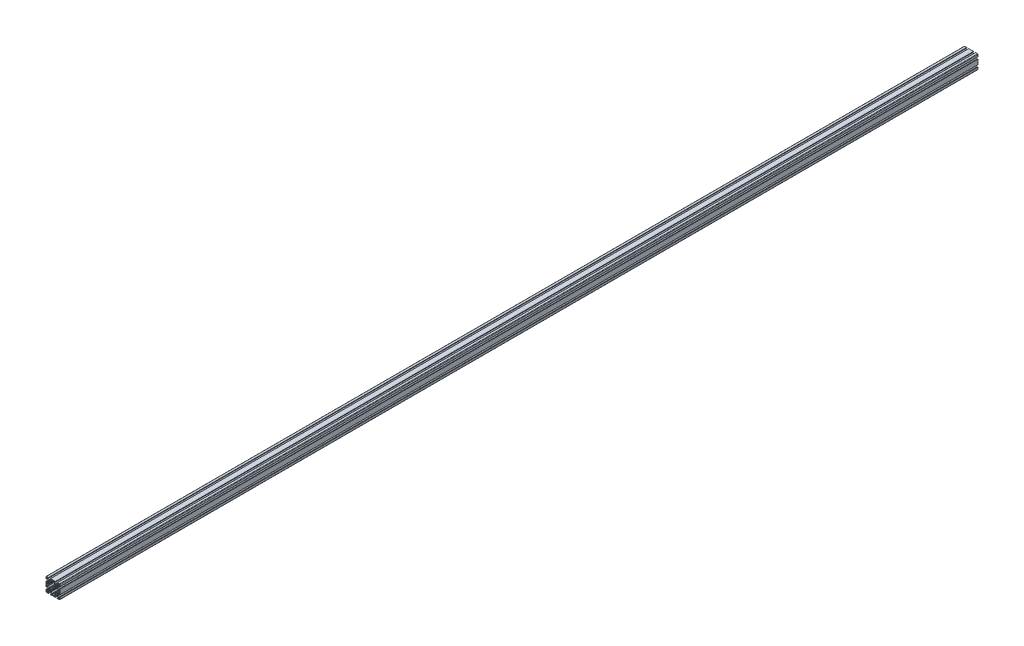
SolidWorks part; units mm, degrees
ref_plane "Front Plane" through (0, 0, 0) normal (0, 0, 1) x (1, 0, 0)
ref_plane "Top Plane" through (0, 0, 0) normal (0, 1, 0) x (1, 0, 0)
ref_plane "Right Plane" through (0, 0, 0) normal (1, 0, 0) x (0, 0, -1)
sketch "Sketch1" plane through (0, 0, 0) normal (0, 0, 1) x (1, 0, 0)
  line L0 (-13.319, -39.4999) -> (-9.88, -39.4999)
  line L1 (-9.5, -39.8799) -> (-9.5, -43.3189)
  line L2 (-9.881, -43.6999) -> (-12.7, -43.6999)
  line L3 (-13.7, -42.6999) -> (-13.7, -39.8809)
  line L4 (39.4999, -43.3189) -> (39.4999, -39.8799)
  line L5 (39.8799, -39.4999) -> (43.3189, -39.4999)
  line L6 (43.6999, -39.8809) -> (43.6999, -42.6999)
  line L7 (42.6999, -43.6999) -> (39.8809, -43.6999)
  line L8 (39.8809, 13.7) -> (42.6999, 13.7)
  line L9 (43.6999, 12.7) -> (43.6999, 9.881)
  line L10 (43.3189, 9.5) -> (39.8799, 9.5)
  line L11 (39.4999, 9.88) -> (39.4999, 13.319)
  line L12 (-9.5, 13.319) -> (-9.5, 9.88)
  line L13 (-9.88, 9.5) -> (-13.319, 9.5)
  line L14 (-13.7, 9.881) -> (-13.7, 12.7)
  line L15 (-12.7, 13.7) -> (-9.881, 13.7)
  line L16 (-1.4942, -3.1981) -> (-2.4733, -3.9799)
  line L17 (-3.9799, -2.4733) -> (-3.1981, -1.4942)
  line L18 (-3.1981, 1.4942) -> (-3.9799, 2.4733)
  line L19 (-2.4733, 3.9799) -> (-1.4942, 3.1981)
  line L20 (1.4942, 3.1981) -> (2.4733, 3.9799)
  line L21 (3.9799, 2.4733) -> (3.1981, 1.4942)
  line L22 (3.1981, -1.4942) -> (3.9799, -2.4733)
  line L23 (2.4733, -3.9799) -> (1.4942, -3.1981)
  line L24 (28.5057, -3.1981) -> (27.5266, -3.9799)
  line L25 (26.02, -2.4733) -> (26.8018, -1.4942)
  line L26 (26.8018, 1.4942) -> (26.02, 2.4733)
  line L27 (27.5266, 3.9799) -> (28.5057, 3.1981)
  line L28 (31.4942, 3.1981) -> (32.4733, 3.9799)
  line L29 (33.9799, 2.4733) -> (33.1981, 1.4942)
  line L30 (33.1981, -1.4942) -> (33.9799, -2.4733)
  line L31 (32.4733, -3.9799) -> (31.4942, -3.1981)
  line L32 (-1.4942, -33.1981) -> (-2.4733, -33.9799)
  line L33 (-3.9799, -32.4733) -> (-3.1981, -31.4942)
  line L34 (-3.1981, -28.5057) -> (-3.9799, -27.5266)
  line L35 (-2.4733, -26.02) -> (-1.4942, -26.8018)
  line L36 (1.4942, -26.8018) -> (2.4733, -26.02)
  line L37 (3.9799, -27.5266) -> (3.1981, -28.5057)
  line L38 (3.1981, -31.4942) -> (3.9799, -32.4733)
  line L39 (2.4733, -33.9799) -> (1.4942, -33.1981)
  line L40 (28.5057, -33.1981) -> (27.5266, -33.9799)
  line L41 (26.02, -32.4733) -> (26.8018, -31.4942)
  line L42 (26.8018, -28.5057) -> (26.02, -27.5266)
  line L43 (27.5266, -26.02) -> (28.5057, -26.8018)
  line L44 (31.4942, -26.8018) -> (32.4733, -26.02)
  line L45 (33.9799, -27.5266) -> (33.1981, -28.5057)
  line L46 (33.1981, -31.4942) -> (33.9799, -32.4733)
  line L47 (32.4733, -33.9799) -> (31.4942, -33.1981)
  line L48 (42.7999, -10.95) -> (42.7999, -19.05)
  line L49 (42.2999, -19.55) -> (39.2681, -19.55)
  line L50 (38.2075, -19.9893) -> (34.178, -24.0188)
  line L51 (33.8244, -24.1653) -> (30.9499, -24.1653)
  line L52 (30.9499, -24.1653) -> (29.9999, -24.6753)
  line L53 (29.9999, -24.6753) -> (29.0499, -24.1653)
  line L54 (29.0499, -24.1653) -> (26.1653, -24.1653)
  line L55 (24.1653, -26.1653) -> (24.1653, -29.1124)
  line L56 (24.1653, -29.1124) -> (24.6753, -30.0624)
  line L57 (24.6753, -30.0624) -> (24.1653, -31.0124)
  line L58 (24.1653, -31.0124) -> (24.1653, -33.8244)
  line L59 (24.0188, -34.178) -> (19.9893, -38.2075)
  line L60 (19.55, -39.2681) -> (19.55, -42.2999)
  line L61 (19.05, -42.7999) -> (10.95, -42.7999)
  line L62 (10.45, -42.2999) -> (10.45, -39.2681)
  line L63 (10.0106, -38.2075) -> (5.9811, -34.178)
  line L64 (5.8347, -33.8244) -> (5.8347, -31.0124)
  line L65 (5.8347, -31.0124) -> (5.3247, -30.0624)
  line L66 (5.3247, -30.0624) -> (5.8347, -29.1124)
  line L67 (5.8347, -29.1124) -> (5.8347, -26.1653)
  line L68 (3.8347, -24.1653) -> (0.95, -24.1653)
  line L69 (0.95, -24.1653) -> (0, -24.6753)
  line L70 (0, -24.6753) -> (-0.95, -24.1653)
  line L71 (-0.95, -24.1653) -> (-3.8245, -24.1653)
  line L72 (-4.178, -24.0188) -> (-8.2075, -19.9893)
  line L73 (-9.2682, -19.55) -> (-12.3, -19.55)
  line L74 (-12.8, -19.05) -> (-12.8, -10.95)
  line L75 (-12.3, -10.45) -> (-9.2682, -10.45)
  line L76 (-8.2075, -10.0106) -> (-4.178, -5.9811)
  line L77 (-3.8245, -5.8347) -> (-0.95, -5.8347)
  line L78 (-0.95, -5.8347) -> (0, -5.3247)
  line L79 (0, -5.3247) -> (0.95, -5.8347)
  line L80 (0.95, -5.8347) -> (3.8347, -5.8347)
  line L81 (5.8347, -3.8347) -> (5.8347, -1.0125)
  line L82 (5.8347, -1.0125) -> (5.3247, -0.0625)
  line L83 (5.3247, -0.0625) -> (5.8347, 0.8875)
  line L84 (5.8347, 0.8875) -> (5.8347, 3.8245)
  line L85 (5.9811, 4.178) -> (10.0106, 8.2075)
  line L86 (10.45, 9.2682) -> (10.45, 12.3)
  line L87 (10.95, 12.8) -> (19.05, 12.8)
  line L88 (19.55, 12.3) -> (19.55, 9.2682)
  line L89 (19.9893, 8.2075) -> (24.0188, 4.178)
  line L90 (24.1653, 3.8245) -> (24.1653, 0.8875)
  line L91 (24.1653, 0.8875) -> (24.6753, -0.0625)
  line L92 (24.6753, -0.0625) -> (24.1653, -1.0125)
  line L93 (24.1653, -1.0125) -> (24.1653, -3.8347)
  line L94 (26.1653, -5.8347) -> (29.0499, -5.8347)
  line L95 (29.0499, -5.8347) -> (29.9999, -5.3247)
  line L96 (29.9999, -5.3247) -> (30.9499, -5.8347)
  line L97 (30.9499, -5.8347) -> (33.8244, -5.8347)
  line L98 (34.178, -5.9811) -> (38.2075, -10.0106)
  line L99 (39.2681, -10.45) -> (42.2999, -10.45)
  line L100 (-14.5, -25.9999) -> (-13.2425, -25.9999)
  line L101 (-12.7425, -25.4999) -> (-12.7425, -22.2674)
  line L102 (-12.2428, -21.75) -> (-10.2602, -21.75)
  line L103 (-9.9067, -21.8964) -> (-5.9811, -25.8219)
  line L104 (-5.8347, -26.1755) -> (-5.8347, -29.1124)
  line L105 (-5.8347, -29.1124) -> (-5.3247, -30.0624)
  line L106 (-5.3247, -30.0624) -> (-5.8347, -31.0124)
  line L107 (-5.8347, -31.0124) -> (-5.8347, -33.8244)
  line L108 (-5.9811, -34.178) -> (-9.9067, -38.1035)
  line L109 (-10.2602, -38.2499) -> (-12.2428, -38.2499)
  line L110 (-12.7425, -37.7325) -> (-12.7425, -34.4999)
  line L111 (-13.2425, -33.9999) -> (-14.5, -33.9999)
  line L112 (-15, -34.4999) -> (-15, -42.9999)
  line L113 (-13, -44.9999) -> (-4.5, -44.9999)
  line L114 (-4, -44.4999) -> (-4, -43.2424)
  line L115 (-4.5, -42.7424) -> (-7.7325, -42.7424)
  line L116 (-8.25, -42.2427) -> (-8.25, -40.2601)
  line L117 (-8.1035, -39.9066) -> (-4.178, -35.9811)
  line L118 (-3.8245, -35.8346) -> (-0.95, -35.8346)
  line L119 (-0.95, -35.8346) -> (0, -35.3246)
  line L120 (0, -35.3246) -> (0.95, -35.8346)
  line L121 (0.95, -35.8346) -> (3.8245, -35.8346)
  line L122 (4.178, -35.9811) -> (8.1035, -39.9066)
  line L123 (8.25, -40.2601) -> (8.25, -42.2427)
  line L124 (7.7325, -42.7424) -> (4.5, -42.7424)
  line L125 (4, -43.2424) -> (4, -44.4999)
  line L126 (4.5, -44.9999) -> (25.4999, -44.9999)
  line L127 (25.9999, -44.4999) -> (25.9999, -43.2424)
  line L128 (25.4999, -42.7424) -> (22.2674, -42.7424)
  line L129 (21.75, -42.2427) -> (21.75, -40.2601)
  line L130 (21.8964, -39.9066) -> (25.8219, -35.9811)
  line L131 (26.1755, -35.8346) -> (29.0499, -35.8346)
  line L132 (29.0499, -35.8346) -> (29.9999, -35.3246)
  line L133 (29.9999, -35.3246) -> (30.9499, -35.8346)
  line L134 (30.9499, -35.8346) -> (33.8244, -35.8346)
  line L135 (34.178, -35.9811) -> (38.1035, -39.9066)
  line L136 (38.2499, -40.2601) -> (38.2499, -42.2427)
  line L137 (37.7325, -42.7424) -> (34.4999, -42.7424)
  line L138 (33.9999, -43.2424) -> (33.9999, -44.4999)
  line L139 (34.4999, -44.9999) -> (42.9999, -44.9999)
  line L140 (44.9999, -42.9999) -> (44.9999, -34.4999)
  line L141 (44.4999, -33.9999) -> (43.2424, -33.9999)
  line L142 (42.7424, -34.4999) -> (42.7424, -37.7325)
  line L143 (42.2427, -38.2499) -> (40.2601, -38.2499)
  line L144 (39.9066, -38.1035) -> (35.9811, -34.178)
  line L145 (35.8346, -33.8244) -> (35.8346, -31.0124)
  line L146 (35.8346, -31.0124) -> (35.3246, -30.0624)
  line L147 (35.3246, -30.0624) -> (35.8346, -29.1124)
  line L148 (35.8346, -29.1124) -> (35.8346, -26.1755)
  line L149 (35.9811, -25.8219) -> (39.9066, -21.8964)
  line L150 (40.2601, -21.75) -> (42.2427, -21.75)
  line L151 (42.7424, -22.2674) -> (42.7424, -25.4999)
  line L152 (43.2424, -25.9999) -> (44.4999, -25.9999)
  line L153 (44.9999, -25.4999) -> (44.9999, -4.5)
  line L154 (44.4999, -4) -> (43.2424, -4)
  line L155 (42.7424, -4.5) -> (42.7424, -7.7325)
  line L156 (42.2427, -8.25) -> (40.2601, -8.25)
  line L157 (39.9066, -8.1035) -> (35.9811, -4.178)
  line L158 (35.8346, -3.8245) -> (35.8346, -1.0125)
  line L159 (35.8346, -1.0125) -> (35.3246, -0.0625)
  line L160 (35.3246, -0.0625) -> (35.8346, 0.8875)
  line L161 (35.8346, 0.8875) -> (35.8346, 3.8245)
  line L162 (35.9811, 4.178) -> (39.9066, 8.1035)
  line L163 (40.2601, 8.25) -> (42.2427, 8.25)
  line L164 (42.7424, 7.7325) -> (42.7424, 4.5)
  line L165 (43.2424, 4) -> (44.4999, 4)
  line L166 (44.9999, 4.5) -> (44.9999, 13)
  line L167 (42.9999, 15) -> (34.4999, 15)
  line L168 (33.9999, 14.5) -> (33.9999, 13.2425)
  line L169 (34.4999, 12.7425) -> (37.7325, 12.7425)
  line L170 (38.2499, 12.2428) -> (38.2499, 10.2602)
  line L171 (38.1035, 9.9067) -> (34.178, 5.9811)
  line L172 (33.8244, 5.8347) -> (30.9499, 5.8347)
  line L173 (30.9499, 5.8347) -> (29.9999, 5.3247)
  line L174 (29.9999, 5.3247) -> (29.0499, 5.8347)
  line L175 (29.0499, 5.8347) -> (26.1755, 5.8347)
  line L176 (25.8219, 5.9811) -> (21.8964, 9.9067)
  line L177 (21.75, 10.2602) -> (21.75, 12.2428)
  line L178 (22.2674, 12.7425) -> (25.4999, 12.7425)
  line L179 (25.9999, 13.2425) -> (25.9999, 14.5)
  line L180 (25.4999, 15) -> (4.5, 15)
  line L181 (4, 14.5) -> (4, 13.2425)
  line L182 (4.5, 12.7425) -> (7.7325, 12.7425)
  line L183 (8.25, 12.2428) -> (8.25, 10.2602)
  line L184 (8.1035, 9.9067) -> (4.178, 5.9811)
  line L185 (3.8245, 5.8347) -> (0.95, 5.8347)
  line L186 (0.95, 5.8347) -> (0, 5.3247)
  line L187 (0, 5.3247) -> (-0.95, 5.8347)
  line L188 (-0.95, 5.8347) -> (-3.8245, 5.8347)
  line L189 (-4.178, 5.9811) -> (-8.1035, 9.9067)
  line L190 (-8.25, 10.2602) -> (-8.25, 12.2428)
  line L191 (-7.7325, 12.7425) -> (-4.5, 12.7425)
  line L192 (-4, 13.2425) -> (-4, 14.5)
  line L193 (-4.5, 15) -> (-13, 15)
  line L194 (-15, 13) -> (-15, 4.5)
  line L195 (-14.5, 4) -> (-13.2425, 4)
  line L196 (-12.7425, 4.5) -> (-12.7425, 7.7325)
  line L197 (-12.2428, 8.25) -> (-10.2602, 8.25)
  line L198 (-9.9067, 8.1035) -> (-5.9811, 4.178)
  line L199 (-5.8347, 3.8245) -> (-5.8347, 0.8875)
  line L200 (-5.8347, 0.8875) -> (-5.3247, -0.0625)
  line L201 (-5.3247, -0.0625) -> (-5.8347, -1.0125)
  line L202 (-5.8347, -1.0125) -> (-5.8347, -3.8245)
  line L203 (-5.9811, -4.178) -> (-9.9067, -8.1035)
  line L204 (-10.2602, -8.25) -> (-12.2428, -8.25)
  line L205 (-12.7425, -7.7325) -> (-12.7425, -4.5)
  line L206 (-13.2425, -4) -> (-14.5, -4)
  line L207 (-15, -4.5) -> (-15, -25.4999)
  arc A0 (-13.319, -39.4999) -> (-13.7, -39.8809) centre (-13.319, -39.8809) ccw
  arc A1 (-9.5, -39.8799) -> (-9.88, -39.4999) centre (-9.88, -39.8799) ccw
  arc A2 (-9.881, -43.6999) -> (-9.5, -43.3189) centre (-9.881, -43.3189) ccw
  arc A3 (-13.7, -42.6999) -> (-12.7, -43.6999) centre (-12.7, -42.6999) ccw
  arc A4 (39.4999, -43.3189) -> (39.8809, -43.6999) centre (39.8809, -43.3189) ccw
  arc A5 (39.8799, -39.4999) -> (39.4999, -39.8799) centre (39.8799, -39.8799) ccw
  arc A6 (43.6999, -39.8809) -> (43.3189, -39.4999) centre (43.3189, -39.8809) ccw
  arc A7 (42.6999, -43.6999) -> (43.6999, -42.6999) centre (42.6999, -42.6999) ccw
  arc A8 (39.8809, 13.7) -> (39.4999, 13.319) centre (39.8809, 13.319) ccw
  arc A9 (43.6999, 12.7) -> (42.6999, 13.7) centre (42.6999, 12.7) ccw
  arc A10 (43.3189, 9.5) -> (43.6999, 9.881) centre (43.3189, 9.881) ccw
  arc A11 (39.4999, 9.88) -> (39.8799, 9.5) centre (39.8799, 9.88) ccw
  arc A12 (-9.5, 13.319) -> (-9.881, 13.7) centre (-9.881, 13.319) ccw
  arc A13 (-9.88, 9.5) -> (-9.5, 9.88) centre (-9.88, 9.88) ccw
  arc A14 (-13.7, 9.881) -> (-13.319, 9.5) centre (-13.319, 9.881) ccw
  arc A15 (-12.7, 13.7) -> (-13.7, 12.7) centre (-12.7, 12.7) ccw
  arc A16 (-1.4942, -3.1981) -> (1.4942, -3.1981) centre (0, 0) ccw
  arc A17 (-3.9799, -2.4733) -> (-2.4733, -3.9799) centre (-3.1422, -3.1422) ccw
  arc A18 (-3.1981, 1.4942) -> (-3.1981, -1.4942) centre (0, 0) ccw
  arc A19 (-2.4733, 3.9799) -> (-3.9799, 2.4733) centre (-3.1422, 3.1422) ccw
  arc A20 (1.4942, 3.1981) -> (-1.4942, 3.1981) centre (0, 0) ccw
  arc A21 (3.9799, 2.4733) -> (2.4733, 3.9799) centre (3.1422, 3.1422) ccw
  arc A22 (3.1981, -1.4942) -> (3.1981, 1.4942) centre (0, 0) ccw
  arc A23 (2.4733, -3.9799) -> (3.9799, -2.4733) centre (3.1422, -3.1422) ccw
  arc A24 (28.5057, -3.1981) -> (31.4942, -3.1981) centre (29.9999, 0) ccw
  arc A25 (26.02, -2.4733) -> (27.5266, -3.9799) centre (26.8577, -3.1422) ccw
  arc A26 (26.8018, 1.4942) -> (26.8018, -1.4942) centre (29.9999, 0) ccw
  arc A27 (27.5266, 3.9799) -> (26.02, 2.4733) centre (26.8577, 3.1422) ccw
  arc A28 (31.4942, 3.1981) -> (28.5057, 3.1981) centre (29.9999, 0) ccw
  arc A29 (33.9799, 2.4733) -> (32.4733, 3.9799) centre (33.1422, 3.1422) ccw
  arc A30 (33.1981, -1.4942) -> (33.1981, 1.4942) centre (29.9999, 0) ccw
  arc A31 (32.4733, -3.9799) -> (33.9799, -2.4733) centre (33.1422, -3.1422) ccw
  arc A32 (-1.4942, -33.1981) -> (1.4942, -33.1981) centre (0, -29.9999) ccw
  arc A33 (-3.9799, -32.4733) -> (-2.4733, -33.9799) centre (-3.1422, -33.1422) ccw
  arc A34 (-3.1981, -28.5057) -> (-3.1981, -31.4942) centre (0, -29.9999) ccw
  arc A35 (-2.4733, -26.02) -> (-3.9799, -27.5266) centre (-3.1422, -26.8577) ccw
  arc A36 (1.4942, -26.8018) -> (-1.4942, -26.8018) centre (0, -29.9999) ccw
  arc A37 (3.9799, -27.5266) -> (2.4733, -26.02) centre (3.1422, -26.8577) ccw
  arc A38 (3.1981, -31.4942) -> (3.1981, -28.5057) centre (0, -29.9999) ccw
  arc A39 (2.4733, -33.9799) -> (3.9799, -32.4733) centre (3.1422, -33.1422) ccw
  arc A40 (28.5057, -33.1981) -> (31.4942, -33.1981) centre (29.9999, -29.9999) ccw
  arc A41 (26.02, -32.4733) -> (27.5266, -33.9799) centre (26.8577, -33.1422) ccw
  arc A42 (26.8018, -28.5057) -> (26.8018, -31.4942) centre (29.9999, -29.9999) ccw
  arc A43 (27.5266, -26.02) -> (26.02, -27.5266) centre (26.8577, -26.8577) ccw
  arc A44 (31.4942, -26.8018) -> (28.5057, -26.8018) centre (29.9999, -29.9999) ccw
  arc A45 (33.9799, -27.5266) -> (32.4733, -26.02) centre (33.1422, -26.8577) ccw
  arc A46 (33.1981, -31.4942) -> (33.1981, -28.5057) centre (29.9999, -29.9999) ccw
  arc A47 (32.4733, -33.9799) -> (33.9799, -32.4733) centre (33.1422, -33.1422) ccw
  arc A48 (42.7999, -10.95) -> (42.2999, -10.45) centre (42.2999, -10.95) ccw
  arc A49 (42.2999, -19.55) -> (42.7999, -19.05) centre (42.2999, -19.05) ccw
  arc A50 (39.2681, -19.55) -> (38.2075, -19.9893) centre (39.2681, -21.05) ccw
  arc A51 (33.8244, -24.1653) -> (34.178, -24.0188) centre (33.8244, -23.6653) ccw
  arc A52 (26.1653, -24.1653) -> (24.1653, -26.1653) centre (26.1653, -26.1653) ccw
  arc A53 (24.0188, -34.178) -> (24.1653, -33.8244) centre (23.6653, -33.8244) ccw
  arc A54 (19.9893, -38.2075) -> (19.55, -39.2681) centre (21.05, -39.2681) ccw
  arc A55 (19.05, -42.7999) -> (19.55, -42.2999) centre (19.05, -42.2999) ccw
  arc A56 (10.45, -42.2999) -> (10.95, -42.7999) centre (10.95, -42.2999) ccw
  arc A57 (10.45, -39.2681) -> (10.0106, -38.2075) centre (8.95, -39.2681) ccw
  arc A58 (5.8347, -33.8244) -> (5.9811, -34.178) centre (6.3347, -33.8244) ccw
  arc A59 (5.8347, -26.1653) -> (3.8347, -24.1653) centre (3.8347, -26.1653) ccw
  arc A60 (-4.178, -24.0188) -> (-3.8245, -24.1653) centre (-3.8245, -23.6653) ccw
  arc A61 (-8.2075, -19.9893) -> (-9.2682, -19.55) centre (-9.2682, -21.05) ccw
  arc A62 (-12.8, -19.05) -> (-12.3, -19.55) centre (-12.3, -19.05) ccw
  arc A63 (-12.3, -10.45) -> (-12.8, -10.95) centre (-12.3, -10.95) ccw
  arc A64 (-9.2682, -10.45) -> (-8.2075, -10.0106) centre (-9.2682, -8.95) ccw
  arc A65 (-3.8245, -5.8347) -> (-4.178, -5.9811) centre (-3.8245, -6.3347) ccw
  arc A66 (3.8347, -5.8347) -> (5.8347, -3.8347) centre (3.8347, -3.8347) ccw
  arc A67 (5.9811, 4.178) -> (5.8347, 3.8245) centre (6.3347, 3.8245) ccw
  arc A68 (10.0106, 8.2075) -> (10.45, 9.2682) centre (8.95, 9.2682) ccw
  arc A69 (10.95, 12.8) -> (10.45, 12.3) centre (10.95, 12.3) ccw
  arc A70 (19.55, 12.3) -> (19.05, 12.8) centre (19.05, 12.3) ccw
  arc A71 (19.55, 9.2682) -> (19.9893, 8.2075) centre (21.05, 9.2682) ccw
  arc A72 (24.1653, 3.8245) -> (24.0188, 4.178) centre (23.6653, 3.8245) ccw
  arc A73 (24.1653, -3.8347) -> (26.1653, -5.8347) centre (26.1653, -3.8347) ccw
  arc A74 (34.178, -5.9811) -> (33.8244, -5.8347) centre (33.8244, -6.3347) ccw
  arc A75 (38.2075, -10.0106) -> (39.2681, -10.45) centre (39.2681, -8.95) ccw
  arc A76 (-13.2425, -25.9999) -> (-12.7425, -25.4999) centre (-13.2425, -25.4999) ccw
  arc A77 (-12.2428, -21.75) -> (-12.7425, -22.2674) centre (-12.2428, -22.25) ccw
  arc A78 (-9.9067, -21.8964) -> (-10.2602, -21.75) centre (-10.2602, -22.25) ccw
  arc A79 (-5.8347, -26.1755) -> (-5.9811, -25.8219) centre (-6.3347, -26.1755) ccw
  arc A80 (-5.9811, -34.178) -> (-5.8347, -33.8244) centre (-6.3347, -33.8244) ccw
  arc A81 (-10.2602, -38.2499) -> (-9.9067, -38.1035) centre (-10.2602, -37.7499) ccw
  arc A82 (-12.7425, -37.7325) -> (-12.2428, -38.2499) centre (-12.2428, -37.7499) ccw
  arc A83 (-12.7425, -34.4999) -> (-13.2425, -33.9999) centre (-13.2425, -34.4999) ccw
  arc A84 (-14.5, -33.9999) -> (-15, -34.4999) centre (-14.5, -34.4999) ccw
  arc A85 (-15, -42.9999) -> (-13, -44.9999) centre (-13, -42.9999) ccw
  arc A86 (-4.5, -44.9999) -> (-4, -44.4999) centre (-4.5, -44.4999) ccw
  arc A87 (-4, -43.2424) -> (-4.5, -42.7424) centre (-4.5, -43.2424) ccw
  arc A88 (-8.25, -42.2427) -> (-7.7325, -42.7424) centre (-7.75, -42.2427) ccw
  arc A89 (-8.1035, -39.9066) -> (-8.25, -40.2601) centre (-7.75, -40.2601) ccw
  arc A90 (-3.8245, -35.8346) -> (-4.178, -35.9811) centre (-3.8245, -36.3346) ccw
  arc A91 (4.178, -35.9811) -> (3.8245, -35.8346) centre (3.8245, -36.3346) ccw
  arc A92 (8.25, -40.2601) -> (8.1035, -39.9066) centre (7.75, -40.2601) ccw
  arc A93 (7.7325, -42.7424) -> (8.25, -42.2427) centre (7.75, -42.2427) ccw
  arc A94 (4.5, -42.7424) -> (4, -43.2424) centre (4.5, -43.2424) ccw
  arc A95 (4, -44.4999) -> (4.5, -44.9999) centre (4.5, -44.4999) ccw
  arc A96 (25.4999, -44.9999) -> (25.9999, -44.4999) centre (25.4999, -44.4999) ccw
  arc A97 (25.9999, -43.2424) -> (25.4999, -42.7424) centre (25.4999, -43.2424) ccw
  arc A98 (21.75, -42.2427) -> (22.2674, -42.7424) centre (22.25, -42.2427) ccw
  arc A99 (21.8964, -39.9066) -> (21.75, -40.2601) centre (22.25, -40.2601) ccw
  arc A100 (26.1755, -35.8346) -> (25.8219, -35.9811) centre (26.1755, -36.3346) ccw
  arc A101 (34.178, -35.9811) -> (33.8244, -35.8346) centre (33.8244, -36.3346) ccw
  arc A102 (38.2499, -40.2601) -> (38.1035, -39.9066) centre (37.7499, -40.2601) ccw
  arc A103 (37.7325, -42.7424) -> (38.2499, -42.2427) centre (37.7499, -42.2427) ccw
  arc A104 (34.4999, -42.7424) -> (33.9999, -43.2424) centre (34.4999, -43.2424) ccw
  arc A105 (33.9999, -44.4999) -> (34.4999, -44.9999) centre (34.4999, -44.4999) ccw
  arc A106 (42.9999, -44.9999) -> (44.9999, -42.9999) centre (42.9999, -42.9999) ccw
  arc A107 (44.9999, -34.4999) -> (44.4999, -33.9999) centre (44.4999, -34.4999) ccw
  arc A108 (43.2424, -33.9999) -> (42.7424, -34.4999) centre (43.2424, -34.4999) ccw
  arc A109 (42.2427, -38.2499) -> (42.7424, -37.7325) centre (42.2427, -37.7499) ccw
  arc A110 (39.9066, -38.1035) -> (40.2601, -38.2499) centre (40.2601, -37.7499) ccw
  arc A111 (35.8346, -33.8244) -> (35.9811, -34.178) centre (36.3346, -33.8244) ccw
  arc A112 (35.9811, -25.8219) -> (35.8346, -26.1755) centre (36.3346, -26.1755) ccw
  arc A113 (40.2601, -21.75) -> (39.9066, -21.8964) centre (40.2601, -22.25) ccw
  arc A114 (42.7424, -22.2674) -> (42.2427, -21.75) centre (42.2427, -22.25) ccw
  arc A115 (42.7424, -25.4999) -> (43.2424, -25.9999) centre (43.2424, -25.4999) ccw
  arc A116 (44.4999, -25.9999) -> (44.9999, -25.4999) centre (44.4999, -25.4999) ccw
  arc A117 (44.9999, -4.5) -> (44.4999, -4) centre (44.4999, -4.5) ccw
  arc A118 (43.2424, -4) -> (42.7424, -4.5) centre (43.2424, -4.5) ccw
  arc A119 (42.2427, -8.25) -> (42.7424, -7.7325) centre (42.2427, -7.75) ccw
  arc A120 (39.9066, -8.1035) -> (40.2601, -8.25) centre (40.2601, -7.75) ccw
  arc A121 (35.8346, -3.8245) -> (35.9811, -4.178) centre (36.3346, -3.8245) ccw
  arc A122 (35.9811, 4.178) -> (35.8346, 3.8245) centre (36.3346, 3.8245) ccw
  arc A123 (40.2601, 8.25) -> (39.9066, 8.1035) centre (40.2601, 7.75) ccw
  arc A124 (42.7424, 7.7325) -> (42.2427, 8.25) centre (42.2427, 7.75) ccw
  arc A125 (42.7424, 4.5) -> (43.2424, 4) centre (43.2424, 4.5) ccw
  arc A126 (44.4999, 4) -> (44.9999, 4.5) centre (44.4999, 4.5) ccw
  arc A127 (44.9999, 13) -> (42.9999, 15) centre (42.9999, 13) ccw
  arc A128 (34.4999, 15) -> (33.9999, 14.5) centre (34.4999, 14.5) ccw
  arc A129 (33.9999, 13.2425) -> (34.4999, 12.7425) centre (34.4999, 13.2425) ccw
  arc A130 (38.2499, 12.2428) -> (37.7325, 12.7425) centre (37.7499, 12.2428) ccw
  arc A131 (38.1035, 9.9067) -> (38.2499, 10.2602) centre (37.7499, 10.2602) ccw
  arc A132 (33.8244, 5.8347) -> (34.178, 5.9811) centre (33.8244, 6.3347) ccw
  arc A133 (25.8219, 5.9811) -> (26.1755, 5.8347) centre (26.1755, 6.3347) ccw
  arc A134 (21.75, 10.2602) -> (21.8964, 9.9067) centre (22.25, 10.2602) ccw
  arc A135 (22.2674, 12.7425) -> (21.75, 12.2428) centre (22.25, 12.2428) ccw
  arc A136 (25.4999, 12.7425) -> (25.9999, 13.2425) centre (25.4999, 13.2425) ccw
  arc A137 (25.9999, 14.5) -> (25.4999, 15) centre (25.4999, 14.5) ccw
  arc A138 (4.5, 15) -> (4, 14.5) centre (4.5, 14.5) ccw
  arc A139 (4, 13.2425) -> (4.5, 12.7425) centre (4.5, 13.2425) ccw
  arc A140 (8.25, 12.2428) -> (7.7325, 12.7425) centre (7.75, 12.2428) ccw
  arc A141 (8.1035, 9.9067) -> (8.25, 10.2602) centre (7.75, 10.2602) ccw
  arc A142 (3.8245, 5.8347) -> (4.178, 5.9811) centre (3.8245, 6.3347) ccw
  arc A143 (-4.178, 5.9811) -> (-3.8245, 5.8347) centre (-3.8245, 6.3347) ccw
  arc A144 (-8.25, 10.2602) -> (-8.1035, 9.9067) centre (-7.75, 10.2602) ccw
  arc A145 (-7.7325, 12.7425) -> (-8.25, 12.2428) centre (-7.75, 12.2428) ccw
  arc A146 (-4.5, 12.7425) -> (-4, 13.2425) centre (-4.5, 13.2425) ccw
  arc A147 (-4, 14.5) -> (-4.5, 15) centre (-4.5, 14.5) ccw
  arc A148 (-13, 15) -> (-15, 13) centre (-13, 13) ccw
  arc A149 (-15, 4.5) -> (-14.5, 4) centre (-14.5, 4.5) ccw
  arc A150 (-13.2425, 4) -> (-12.7425, 4.5) centre (-13.2425, 4.5) ccw
  arc A151 (-12.2428, 8.25) -> (-12.7425, 7.7325) centre (-12.2428, 7.75) ccw
  arc A152 (-9.9067, 8.1035) -> (-10.2602, 8.25) centre (-10.2602, 7.75) ccw
  arc A153 (-5.8347, 3.8245) -> (-5.9811, 4.178) centre (-6.3347, 3.8245) ccw
  arc A154 (-5.9811, -4.178) -> (-5.8347, -3.8245) centre (-6.3347, -3.8245) ccw
  arc A155 (-10.2602, -8.25) -> (-9.9067, -8.1035) centre (-10.2602, -7.75) ccw
  arc A156 (-12.7425, -7.7325) -> (-12.2428, -8.25) centre (-12.2428, -7.75) ccw
  arc A157 (-12.7425, -4.5) -> (-13.2425, -4) centre (-13.2425, -4.5) ccw
  arc A158 (-14.5, -4) -> (-15, -4.5) centre (-14.5, -4.5) ccw
  arc A159 (-15, -25.4999) -> (-14.5, -25.9999) centre (-14.5, -25.4999) ccw
extrude "Extrude1" add sketch "Sketch1" against normal blind 4000
